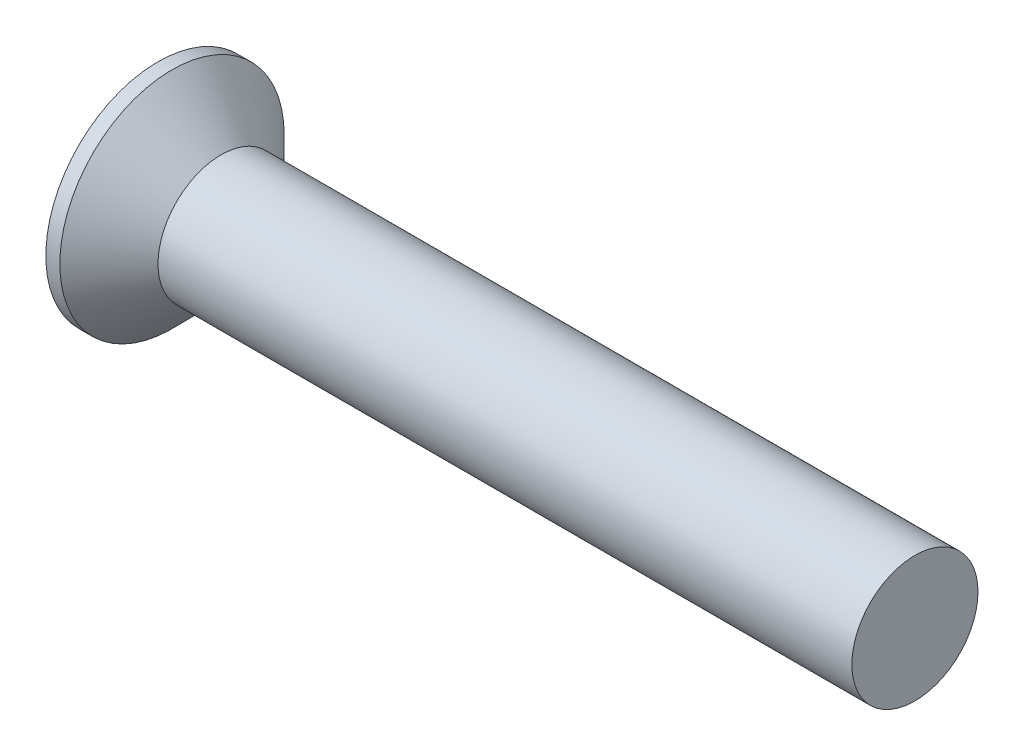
SolidWorks part; units mm, degrees
ref_plane "Front" through (0, 0, 0) normal (0, 0, 1) x (1, 0, 0)
ref_plane "Top" through (0, 0, 0) normal (0, 1, 0) x (1, 0, 0)
ref_plane "Right" through (0, 0, 0) normal (1, 0, 0) x (0, 0, -1)
sketch "Sketch1" plane through (0, 0, 0) normal (0, 0, 1) x (1, 0, 0)
  line L0 (60, 5) -> (8, 5)
  line L1 (8, 5) -> (5, 5)
  line L2 (5, 5) -> (1.11, 8.89)
  line L3 (1.11, 8.89) -> (0, 8.89)
  line L4 (60, 5) -> (60, 0)
  line L5 (4.5158, 0) -> (-89.8219, 0) construction
  line L6 (60, 0) -> (0, 0)
  line L7 (0, 8.89) -> (0, 0)
  dimension "D1" = 45
  dimension "dk" = 17.78
  dimension "l" = 60
  dimension "k" = 5
  dimension "a" = 3
revolve "Base" add sketch "Sketch1" angle 360 about L5
sketch "Sketch6" plane through (0, 0, 0) normal (1, 0, 0) x (0, 0, -1)
  line L0 (-1.9271, 0) -> (2.0512, 0) construction
  line L1 (0, 1.8651) -> (0, -2.0207) construction
  line L2 (1, 1) -> (1, 5)
  line L3 (1, 5) -> (-1, 5)
  line L4 (-1, 1) -> (-1, 5)
  line L5 (1, 1) -> (5, 1)
  line L6 (5, 1) -> (5, -1)
  line L7 (-5, 1) -> (-5, -1)
  line L8 (-1, 1) -> (-5, 1)
  line L9 (-1, -1) -> (-5, -1)
  line L10 (1, -1) -> (5, -1)
  line L11 (-1, -1) -> (-1, -5)
  line L12 (1, -5) -> (-1, -5)
  line L13 (1, -1) -> (1, -5)
  point P16 (-5, 0)
  point P17 (5, 0)
extrude "CrossRecess" cut sketch "Sketch6" along normal blind 2.5
draft "Draft9" type of draft neutral plane draft angle 30 faces to draft 4 parameters "D1"=30
fillet "Fillet5" radius 0.3 4 edges at (1.25, -1, -1) (1.25, -1, 1) (1.25, 1, -1) (1.25, 1, 1)
sketch "Sketch7" plane through (0, 0, 0) normal (1, 0, 0) x (0, 0, -1)
  line L0 (-2.0126, 0) -> (1.9757, 0) construction
  line L1 (0, 1.9314) -> (0, -2.0126) construction
  line L2 (0, 0) -> (1.5555, 1.5555) construction
  line L3 (0, 1.4943) -> (3.5355, 3.5355)
  line L4 (-1.5402, 1.5402) -> (0, 0) construction
  line L5 (1.4943, 0) -> (3.5355, 3.5355)
  line L6 (0, -1.4943) -> (3.5355, -3.5355)
  line L7 (1.4943, 0) -> (3.5355, -3.5355)
  line L8 (-1.4943, 0) -> (-3.5355, -3.5355)
  line L9 (0, -1.4943) -> (-3.5355, -3.5355)
  line L10 (-1.4943, 0) -> (-3.5355, 3.5355)
  line L11 (0, 1.4943) -> (-3.5355, 3.5355)
  dimension "D3" = 15
extrude "Cut-Extrude3" cut sketch "Sketch7" along normal blind 10 draft 20
sketch "Sketch10" plane through (0, 0, 0) normal (0, 0, 1) x (1, 0, 0)
  line L0 (62.2289, 0) -> (-1.9277, 0) construction
  line L1 (5, 5) -> (6.812, 5)
  line L4 (6.812, 5) -> (6.812, 0)
  line L7 (6.812, 0) -> (5, 0)
  line L9 (5, 5) -> (1.11, 8.89) construction
  line L10 (5, 5) -> (5, 0)
  dimension "p" = 1.812
revolve "Revolve2" add sketch "Sketch10" angle 360 about L0
sketch "Sketch8" plane through (0, 0, 0) normal (0, 0, 1) x (1, 0, 0)
  line L0 (22, 5) -> (18.2, 4.188)
  line L1 (18.2, 4.188) -> (5, 4.188)
  line L3 (60, -5) -> (60, 5) construction
  line L6 (5, 4.188) -> (5, 9.188)
  line L7 (5, 9.188) -> (22, 9.188)
  line L8 (22, 9.188) -> (22, 5)
  line L9 (62.4753, 0) -> (52.9594, 0) construction
  dimension "D1" = 5
  dimension "x" = 3.8
sketch "Sketch11" plane through (0, 0, 0) normal (0, 0, 1) x (1, 0, 0)
  line L0 (60, 4.2968) -> (60.406, 5)
  line L1 (60.406, 5) -> (60.406, 5.812)
  line L2 (60.406, 5.812) -> (59.594, 5.812)
  line L3 (59.594, 5.812) -> (59.594, 5)
  line L4 (59.594, 5) -> (60, 4.2968)
  line L5 (60, -5) -> (60, 5) construction
  line L6 (0, 0) -> (66.0064, 0) construction
  dimension "D1" = 10
  dimension "D2" = 0.812
revolve "Cut-Revolve10" [suppressed] cut sketch "Sketch11" angle 360 about L6
pattern_linear "LPattern10" [suppressed] count 53 spacing 0.9744 along (1, 0, 0)
equation "\"D1@Sketch6\" = \"m@Sketch6\" / 5"
equation "\"D1@CrossRecess\" = \"k@Sketch1\" / 2"
equation "\"D1@Sketch11\" = \"d@Sketch1\""
equation "\"D2@Sketch11\" =  ( \"d@Sketch1\" - \"THD_MINOR@ThreadCosmetic1\" )  / 2"
equation "\"D3@LPattern10\" = \"D2@Sketch11\" * 1.2"
equation "\"D1@LPattern10\" = \"bb@ThreadCosmetic1\" / \"D3@LPattern10\" "
